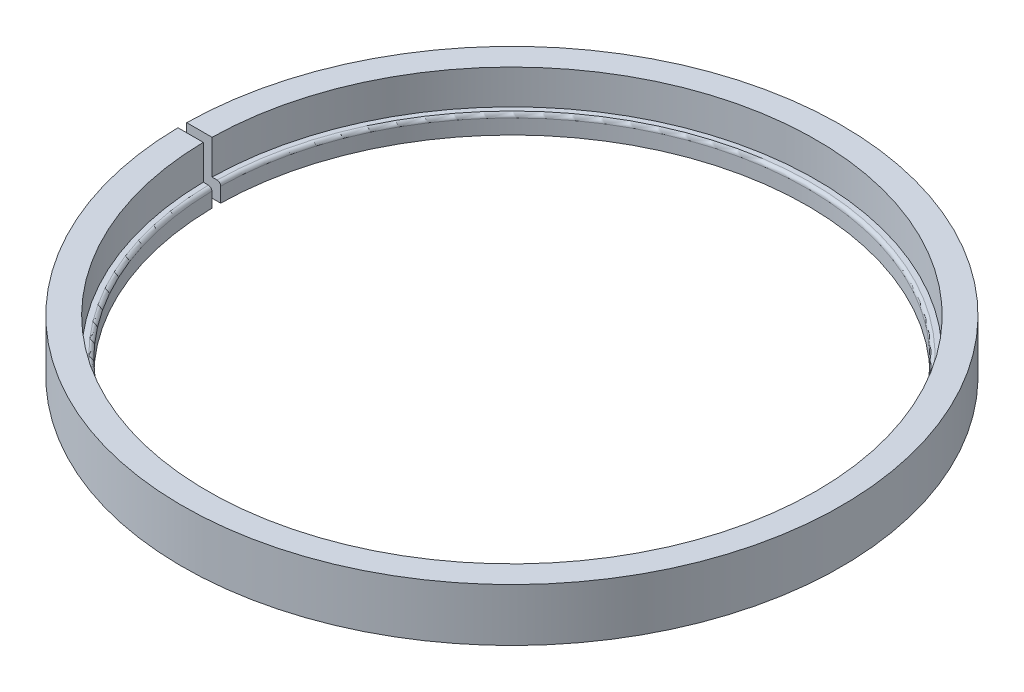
SolidWorks part; units mm, degrees
ref_plane "Front Plane" through (0, 0, 0) normal (0, 0, 1) x (1, 0, 0)
ref_plane "Top Plane" through (0, 0, 0) normal (0, 1, 0) x (1, 0, 0)
ref_plane "Right Plane" through (0, 0, 0) normal (1, 0, 0) x (0, 0, -1)
sketch "Sketch1" plane through (0, 0, 0) normal (0, 0, 1) x (1, 0, 0)
  line L0 (0, 0) -> (0, 51.4902) construction
  line L1 (-118.9355, 6.096) -> (-106.6927, 6.096)
  line L2 (-118.9355, 6.096) -> (-118.9355, 25.146)
  line L3 (-118.9355, 25.146) -> (-109.7915, 25.146)
  line L4 (-109.7915, 25.146) -> (-109.7915, 12.7)
  line L5 (-109.7915, 12.7) -> (-107.9627, 12.7)
  line L6 (-106.6927, 11.43) -> (-106.6927, 6.096)
  line L12 (-109.5375, 12.7) -> (109.5375, 12.7) construction
  line L14 (-106.4387, 11.43) -> (-106.4387, -798.83) construction
  line L15 (-109.5375, 25.4) -> (-109.5375, 12.7) construction
  arc A0 (-107.9627, 12.7) -> (-106.6927, 11.43) centre (-107.9627, 11.43) cw
  dimension "D4" = 1.27
  dimension "D1" = 9.144
  dimension "D2" = 0.254
  dimension "D3" = 19.05
  dimension "D5" = 0.254
  dimension "D6" = 0.254
revolve "Revolve1" add sketch "Sketch1" angle 360 about L0
sketch "Sketch4" plane through (0, 25.146, 0) normal (0, 1, 0) x (1, 0, 0)
  line L2 (-135.0572, -1.5875) -> (-92.8318, -1.5875)
  line L3 (-135.0572, -1.5875) -> (-135.0572, 1.5875)
  line L4 (-135.0572, 1.5875) -> (-92.8318, 1.5875)
  line L5 (-92.8318, -1.5875) -> (-92.8318, 1.5875)
  line L6 (-135.0572, -1.5875) -> (-92.8318, 1.5875) construction
  line L7 (-135.0572, 1.5875) -> (-92.8318, -1.5875) construction
  point P0 (-113.9445, 0)
  dimension "D1" = 3.175
extrude "Cut-Extrude1" cut sketch "Sketch4" against normal through all
sketch "Sketch5" [suppressed] plane through (0, 18.796, 0) normal (0, 1, 0) x (1, 0, 0)
  line L0 (0, 0) -> (0, -252.6615) construction
  line L1 (-118.3465, -11.8223) -> (-102.6184, -169.2676)
  line L2 (-52.07, -215.018) -> (52.07, -215.018)
  line L3 (118.3465, -11.8223) -> (102.6184, -169.2676)
  circle A0 centre (-52.07, -164.218) radius 50.8 construction
  arc A1 (-118.9249, -1.5875) -> (118.9249, -1.5875) centre (0, 0) ccw construction
  arc A2 (-118.3465, -11.8223) -> (118.3465, -11.8223) centre (0, 0) ccw
  arc A3 (-102.6184, -169.2676) -> (-52.07, -215.018) centre (-52.07, -164.218) ccw
  arc A4 (102.6184, -169.2676) -> (52.07, -215.018) centre (52.07, -164.218) cw
  point P16 (0, -215.018)
  dimension "D1" = 101.6
  dimension "D2" = 1.27
  dimension "D3" = 2.54
extrude "Boss-Extrude1" [suppressed] add sketch "Sketch5" against normal up to surface (18.288 mm away)
sketch "Sketch6" [suppressed] plane through (0, 0.508, 0) normal (0, -1, 0) x (1, 0, 0)
  line L0 (0, 0) -> (0, 222.0268) construction
  line L1 (0, 0) -> (0, 252.6615) construction
  circle A0 centre (-52.07, 164.218) radius 31.75
  circle A1 centre (52.07, 164.218) radius 31.75
  dimension "D1" = 63.5
extrude "Boss-Extrude2" [suppressed] add sketch "Sketch6" along normal blind 25.4
ref_plane "Plane2" [suppressed] through (0, 0, 164.218) normal (0, 0, -1) x (-1, 0, 0)
sketch "Sketch11" [suppressed] plane through (0, -24.892, 0) normal (0, -1, 0) x (1, 0, 0)
  circle A0 centre (-52.07, 164.218) radius 22.6228
  dimension "D1" = 45.2456
sketch "Sketch12" [suppressed] plane through (0, 0.508, 0) normal (0, -1, 0) x (1, 0, 0)
  circle A0 centre (-39.333, 165.7705) radius 6.0959
  dimension "D1" = 12.1918
loft "Cut-Loft1" [suppressed] cut profiles "Sketch12", "Sketch11"
mirror "Mirror2" [suppressed] about plane through (0, 0, 0) normal (1, 0, 0)
